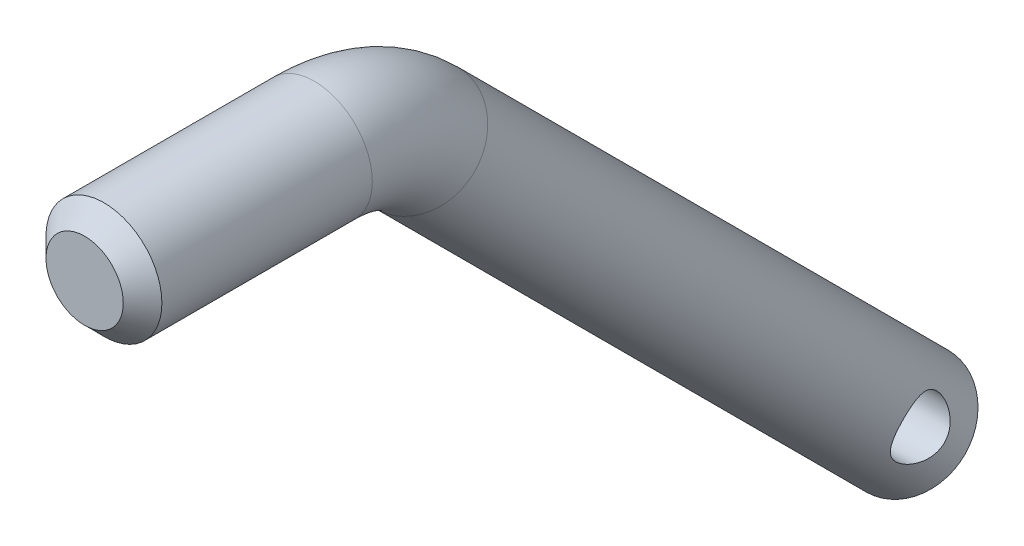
SolidWorks part; units mm, degrees
ref_plane "Face" through (0, 0, 0) normal (0, 0, 1) x (1, 0, 0)
ref_plane "Dessus" through (0, 0, 0) normal (0, 1, 0) x (1, 0, 0)
ref_plane "Droite" through (0, 0, 0) normal (1, 0, 0) x (0, 0, -1)
sketch "Esquisse1" plane through (0, 0, 0) normal (0, 0, 1) x (1, 0, 0)
  circle A0 centre (0, 0) radius 6
  dimension "D1" = 12
sketch "Esquisse2" plane through (0, 0, 0) normal (1, 0, 0) x (0, 0, -1)
  line L0 (0, 0) -> (23.7868, 0)
  line L1 (34.3934, -4.3934) -> (86.5685, -56.5685)
  arc A0 (34.3934, -4.3934) -> (23.7868, 0) centre (23.7868, -15) ccw
  point P6 (30, 0)
  dimension "D4" = 15
  dimension "D1" = 30
  dimension "D2" = 80
  dimension "D3" = 135
sweep "Base-Balayage" add profiles "Esquisse1" path "Esquisse2"
chamfer "Chanfrein1" distance 2 angle 45
sketch "Esquisse3" plane through (0, 0, 0) normal (1, 0, 0) x (0, 0, -1)
  line L0 (34.3934, -4.3934) -> (85.1543, -55.1543) construction
  line L1 (83.7401, -59.397) -> (89.397, -53.7401) construction
  circle A0 centre (80.9117, -50.9117) radius 3
  dimension "D1" = 6
  dimension "D2" = 8
extrude "Enlèv. mat.-Extru.1" cut sketch "Esquisse3" against normal mid plane 14
